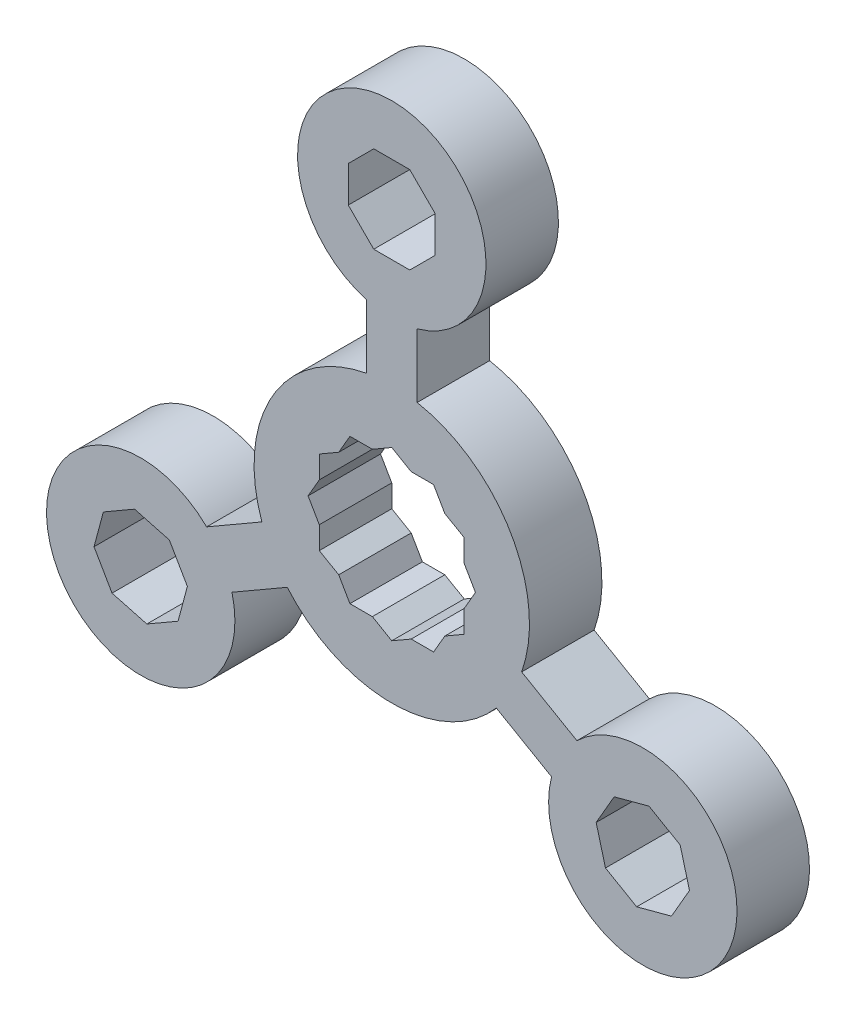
SolidWorks part; units mm, degrees
ref_plane "Alzado" through (0, 0, 0) normal (0, 0, 1) x (1, 0, 0)
ref_plane "Planta" through (0, 0, 0) normal (0, 1, 0) x (1, 0, 0)
ref_plane "Vista lateral" through (0, 0, 0) normal (1, 0, 0) x (0, 0, -1)
sketch "Croquis1" plane through (0, 0, 0) normal (0, 0, 1) x (1, 0, 0)
  line L0 (-3.5, 27.48) -> (-3.5, 18.6748)
  line L1 (3.5, 18.6748) -> (3.5, 27.48)
  line L2 (17.9229, -6.3063) -> (25.5484, -10.7089)
  line L3 (14.4229, -12.3685) -> (22.0484, -16.7711)
  line L4 (-14.4229, -12.3685) -> (-22.0484, -16.7711)
  line L5 (-25.5484, -10.7089) -> (-17.9229, -6.3063)
  line L6 (10, 5.7735) -> (0, 11.547)
  line L7 (34.641, -20) -> (0, 0) construction
  line L8 (0, 0) -> (-34.641, -20) construction
  line L9 (0, 11.547) -> (-10, 5.7735)
  line L10 (-10, 5.7735) -> (-10, -5.7735)
  line L11 (-10, -5.7735) -> (0, -11.547)
  line L12 (0, -11.547) -> (10, -5.7735)
  line L13 (10, -5.7735) -> (10, 5.7735)
  line L14 (-28.2022, -19.1523) -> (-30.6875, -14.8477)
  line L15 (5.7735, 10) -> (-5.7735, 10)
  line L16 (-5.7735, 10) -> (-11.547, 0)
  line L17 (-11.547, 0) -> (-5.7735, -10)
  line L18 (-5.7735, -10) -> (5.7735, -10)
  line L19 (5.7735, -10) -> (11.547, 0)
  line L20 (11.547, 0) -> (5.7735, 10)
  line L21 (-35.4887, -13.5612) -> (-39.7933, -16.0465)
  line L22 (-39.7933, -16.0465) -> (-41.0798, -20.8477)
  line L23 (-41.0798, -20.8477) -> (-38.5945, -25.1523)
  line L24 (-38.5945, -25.1523) -> (-33.7933, -26.4388)
  line L25 (-33.7933, -26.4388) -> (-29.4887, -23.9535)
  line L26 (-29.4887, -23.9535) -> (-28.2022, -19.1523)
  line L27 (-30.6875, -14.8477) -> (-35.4887, -13.5612)
  line L29 (2.4853, 46) -> (-2.4853, 46)
  line L30 (-2.4853, 46) -> (-6, 42.4853)
  line L31 (-6, 42.4853) -> (-6, 37.5147)
  line L32 (-6, 37.5147) -> (-2.4853, 34)
  line L33 (-2.4853, 34) -> (2.4853, 34)
  line L34 (2.4853, 34) -> (6, 37.5147)
  line L35 (6, 37.5147) -> (6, 42.4853)
  line L36 (6, 42.4853) -> (2.4853, 46)
  line L37 (35.4887, -13.5612) -> (30.6875, -14.8477)
  line L38 (30.6875, -14.8477) -> (28.2022, -19.1523)
  line L39 (28.2022, -19.1523) -> (29.4887, -23.9535)
  line L40 (29.4887, -23.9535) -> (33.7933, -26.4388)
  line L41 (33.7933, -26.4388) -> (38.5945, -25.1523)
  line L42 (38.5945, -25.1523) -> (41.0798, -20.8477)
  line L43 (41.0798, -20.8477) -> (39.7933, -16.0465)
  line L44 (39.7933, -16.0465) -> (35.4887, -13.5612)
  arc A0 (-14.4229, -12.3685) -> (14.4229, -12.3685) centre (0, 0) ccw
  arc A1 (3.5, 27.48) -> (-3.5, 27.48) centre (0, 40) ccw
  arc A2 (22.0484, -16.7711) -> (25.5484, -10.7089) centre (34.641, -20) ccw
  arc A3 (-25.5484, -10.7089) -> (-22.0484, -16.7711) centre (-34.641, -20) ccw
  arc A4 (17.9229, -6.3063) -> (3.5, 18.6748) centre (0, 0) ccw
  arc A5 (-3.5, 18.6748) -> (-17.9229, -6.3063) centre (0, 0) ccw
  circle A6 centre (0, 0) radius 10 construction
  circle A7 centre (0, 0) radius 10 construction
  circle A8 centre (-34.641, -20) radius 6 construction
  circle A9 centre (0, 40) radius 6 construction
  circle A10 centre (34.641, -20) radius 6 construction
  dimension "D1" = 19
  dimension "D2" = 13
  dimension "D3" = 40
  dimension "D8" = 13
  dimension "D9" = 13
  dimension "D10" = 20
  dimension "D11" = 19
  dimension "D12" = 40
  dimension "D4" = 7
  dimension "D5" = 120
  dimension "D6" = 7
  dimension "D7" = 7
  dimension "D13" = 12
extrude "Saliente-Extruir1" add sketch "Croquis1" along normal blind 10 contours L0 A5 L5 A3 L4 A0 L3 A2 L2 A4 L1 A1 L20 L19 L13 L12 L18 L11 L17 L10 L16 L9 L15 L6 L27 L14 L26 L25 L24 L23 L22 L21 L36 L35 L34 L33
